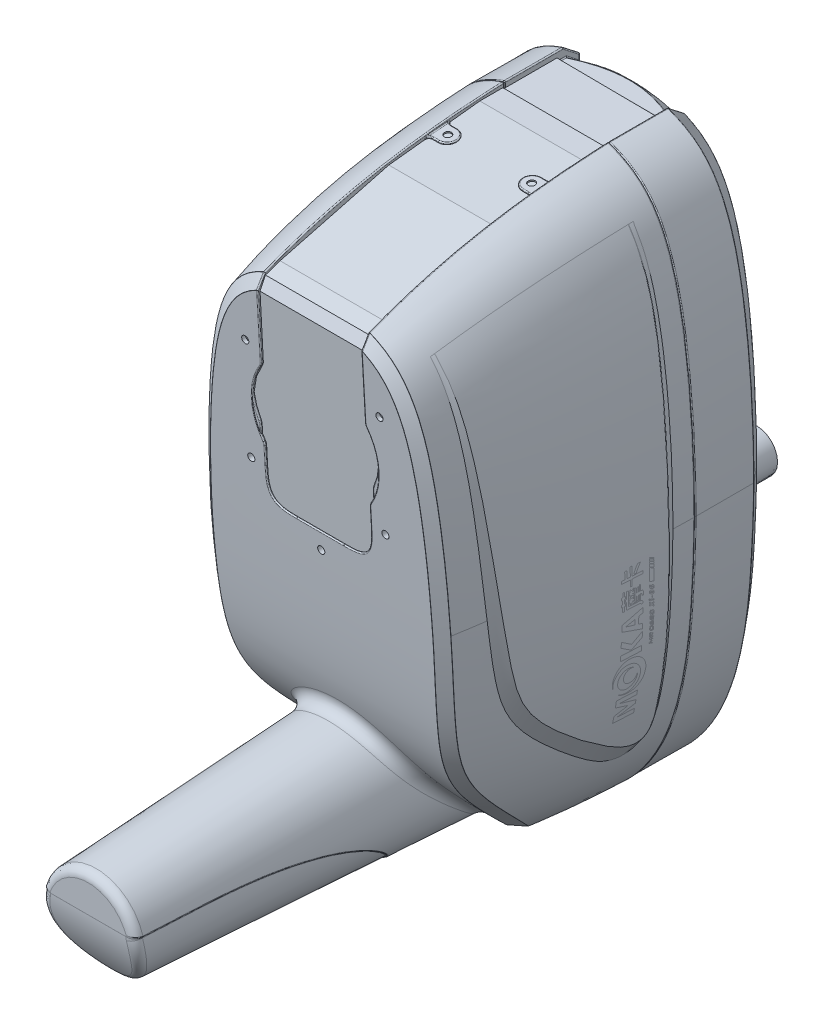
SolidWorks part; units mm, degrees
ref_plane "前视基准面" through (0, 0, 0) normal (0, 0, 1) x (1, 0, 0)
ref_plane "上视基准面" through (0, 0, 0) normal (0, 1, 0) x (1, 0, 0)
ref_plane "右视基准面" through (0, 0, 0) normal (1, 0, 0) x (0, 0, -1)
imported_body "输入1"
imported_body "曲面-输入1"
imported_body "曲面-输入2"
imported_body "曲面-输入3"
imported_body "曲面-输入4"
imported_body "曲面-输入5"
imported_body "曲面-输入6"
imported_body "曲面-输入7"
imported_body "曲面-输入8"
imported_body "曲面-输入9"
imported_body "曲面-输入10"
imported_body "曲面-输入11"
imported_body "曲面-输入12"
imported_body "曲面-输入13"
imported_body "曲面-输入14"
imported_body "曲面-输入15"
imported_body "曲面-输入16"
imported_body "曲面-输入17"
imported_body "曲面-输入18"
imported_body "曲面-输入19"
imported_body "曲面-输入20"
imported_body "曲面-输入21"
imported_body "曲面-输入22"
imported_body "曲面-输入23"
imported_body "曲面-输入24"
imported_body "曲面-输入25"
imported_body "曲面-输入26"
imported_body "曲面-输入27"
imported_body "曲面-输入28"
imported_body "曲面-输入29"
imported_body "曲面-输入30"
imported_body "曲面-输入31"
imported_body "曲面-输入32"
imported_body "曲面-输入33"
imported_body "曲面-输入34"
imported_body "曲面-输入35"
imported_body "曲面-输入36"
imported_body "曲面-输入37"
imported_body "曲面-输入38"
imported_body "曲面-输入39"
imported_body "曲面-输入40"
imported_body "曲面-输入41"
imported_body "曲面-输入42"
imported_body "曲面-输入43"
imported_body "曲面-输入44"
imported_body "曲面-输入45"
imported_body "曲面-输入46"
imported_body "曲面-输入47"
imported_body "曲面-输入48"
imported_body "曲面-输入49"
imported_body "曲面-输入50"
imported_body "曲面-输入51"
imported_body "曲面-输入52"
imported_body "曲面-输入53"
imported_body "曲面-输入54"
imported_body "曲面-输入55"
imported_body "曲面-输入56"
imported_body "曲面-输入57"
imported_body "曲面-输入58"
imported_body "曲面-输入59"
imported_body "曲面-输入60"
sketch "草图1" plane through (0, 0, 0) normal (1, 0, 0) x (0, 0, -1)
  line L0 (25.1456, 228.4229) -> (25.1456, 196.5615)
  line L1 (25.1456, 107.9652) -> (25.1456, 240.7957) construction
  point P2 (25.1456, 196.5615)
  point P5 (25.1456, 228.4229)
surface "曲面-拉伸1" sketch "草图1" parameters "D1"=251
split "分割1" trimming surface bodies 170 bodies to split 109 resulting bodies 171 172
move or copy body "实体-移动/复制1" bodies to move or copy 171 copy no translate (38.5, 17, 0)
move or copy body "实体-移动/复制2" bodies to move or copy 173 copy yes number of copies 1 translate (-77, 0, 0)
combine bodies "组合1" operation type add bodies to combine 173 174 172
